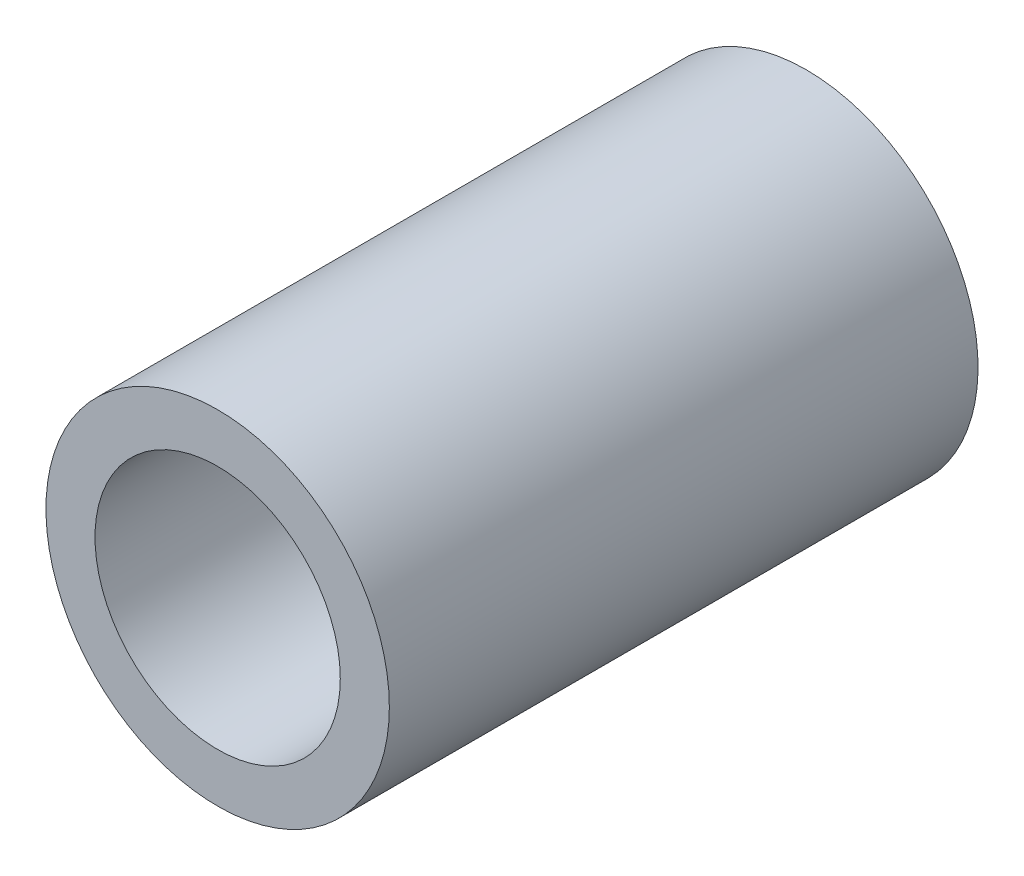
SolidWorks part; units mm, degrees
ref_plane "Front Plane" through (0, 0, 0) normal (0, 0, 1) x (1, 0, 0)
ref_plane "Top Plane" through (0, 0, 0) normal (0, 1, 0) x (1, 0, 0)
ref_plane "Right Plane" through (0, 0, 0) normal (1, 0, 0) x (0, 0, -1)
sketch "Sketch1" plane through (0, 0, 0) normal (0, 0, 1) x (1, 0, 0)
  circle A0 centre (0, 0) radius 100
  dimension "D1" = 200
extrude "Boss-Extrude1" add sketch "Sketch1" along normal blind 5
sketch "Sketch2" plane through (0, 0, 5) normal (0, 0, 1) x (1, 0, 0)
  circle A0 centre (0, 0) radius 12.5
  circle A1 centre (0, 0) radius 17.5
  dimension "D1" = 25
  dimension "D2" = 5
extrude "Boss-Extrude2" add sketch "Sketch2" along normal blind 60
sketch "Sketch3" plane through (0, 0, 5) normal (0, 0, 1) x (1, 0, 0)
  line L0 (52.9602, -56.9668) -> (56.9668, 52.9602) construction
  line L1 (-56.9668, -52.9602) -> (52.9602, -56.9668) construction
  line L2 (-56.9668, -52.9602) -> (-52.9602, 56.9668) construction
  line L3 (-52.9602, 56.9668) -> (56.9668, 52.9602) construction
  line L4 (52.9602, -56.9668) -> (56.9668, 52.9602)
  line L5 (-56.9668, -52.9602) -> (52.9602, -56.9668)
  line L6 (-56.9668, -52.9602) -> (-52.9602, 56.9668)
  line L7 (-52.9602, 56.9668) -> (56.9668, 52.9602)
hole_wizard "Ø3.0 (3) Diameter Hole1" positions "Sketch4" profile "Sketch5" hole size "Ø3.0" standard "DIN"
sketch "Sketch4" plane through (0, 0, 5) normal (0, 0, 1) x (1, 0, 0)
  point P0 (56.9668, 52.9602)
sketch "Sketch5" plane through (56.9668, 52.9602, 5) normal (1, 0, 0) x (0, -1, 0)
  line L0 (0, 0) -> (0, 5)
  line L1 (0, 5) -> (1.5, 5)
  line L2 (1.5, 5) -> (1.5, 0)
  line L5 (1.5, 0) -> (0, 0)
  line L11 (0, -6.35) -> (0, 107.95) construction
  dimension "Thru Hole Dia." = 3
  dimension "Thru Hole Depth" = 5
pattern_curve "CrvPattern1" of "Ø3.0 (3) Diameter Hole1" parameters "D1"=2, "D3"=10, "D2"=2, "D4"=10
sketch "Sketch6" plane through (0, -50, 0) normal (0, 1, 0) x (1, 0, 0)
  line L0 (52.9602, -5) -> (56.9668, -5) construction
  line L1 (-12.5, -5) -> (12.5, -5)
  line L2 (-12.5, -5) -> (-12.5, -35)
  line L3 (-12.5, -35) -> (12.5, -35)
  line L4 (12.5, -5) -> (12.5, -35)
  line L5 (0, -35.75) -> (0, 35.75) construction
  point P6 (0, -35)
  dimension "D1" = 25
  dimension "D2" = 30
extrude "Cut-Extrude1" cut sketch "Sketch6" along normal up to next
fillet "Fillet1" radius 10 2 edges at (12.5, -6.1237, 35) (-12.5, -6.1237, 35)
sketch "Sketch7" plane through (0, 0, 0) normal (0, 1, 0) x (1, 0, 0)
  line L0 (-110, 0) -> (110, 0) construction
  line L1 (-100, -5) -> (100, -5)
  line L2 (-100, -5) -> (-100, 0)
  line L3 (-100, 0) -> (100, 0)
  line L4 (100, -5) -> (100, 0)
extrude "Cut-Extrude2" cut sketch "Sketch7" against normal mid plane 260
